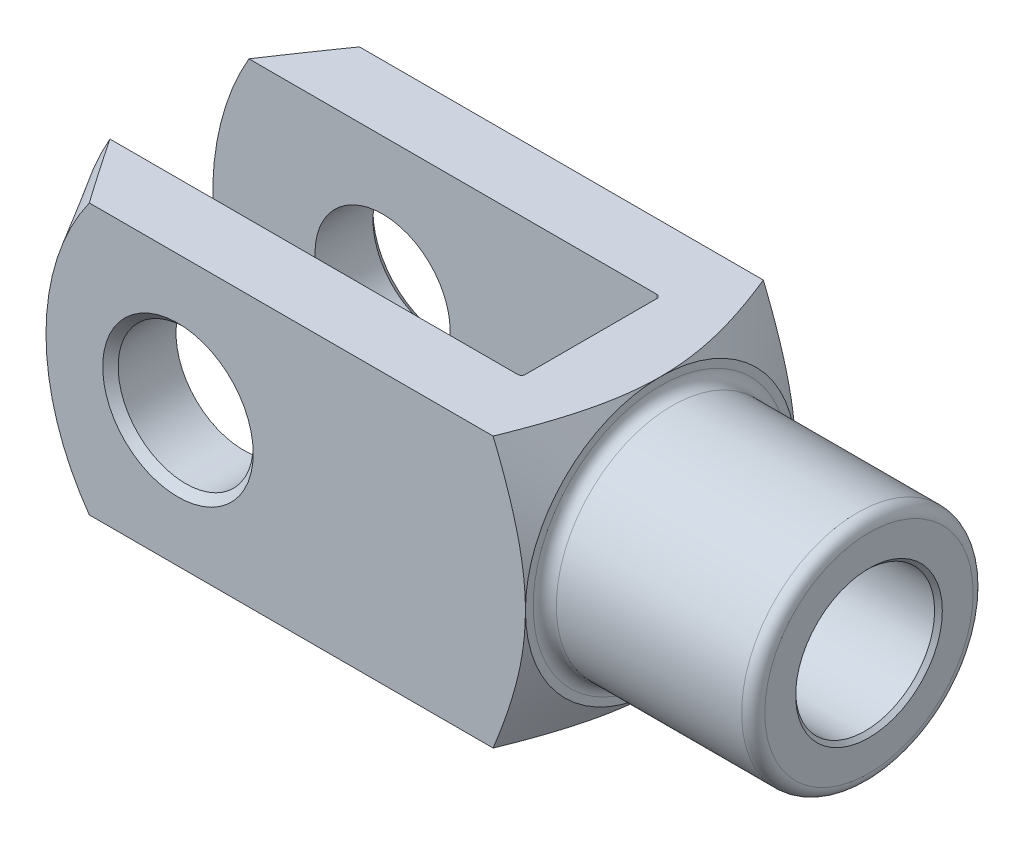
SolidWorks part; units mm, degrees
ref_plane "Front Plane" through (0, 0, 0) normal (0, 0, 1) x (1, 0, 0)
ref_plane "Top Plane" through (0, 0, 0) normal (0, 1, 0) x (1, 0, 0)
ref_plane "Right Plane" through (0, 0, 0) normal (1, 0, 0) x (0, 0, -1)
sketch "Sketch1" plane through (0, 0, 0) normal (1, 0, 0) x (0, 0, -1)
  line L0 (0, 0) -> (0, 50000) construction
  line L1 (0, 0) -> (50000, 0) construction
  line L2 (-35, -35) -> (-35, 35)
  line L3 (-35, 35) -> (35, 35)
  line L4 (35, -35) -> (35, 35)
  line L5 (-35, -35) -> (35, -35)
  point P9 (0, 35)
  point P11 (35, 0)
  point P12 (-35, 0)
  dimension "D1" = 70
  dimension "D2" = 70
extrude "Extrude1" add sketch "Sketch1" against normal blind 188
sketch "Sketch2" plane through (0, 0, 0) normal (1, 0, 0) x (0, 0, -1)
  circle A0 centre (0, 0) radius 30
  circle A1 centre (0, 0) radius 60
  dimension "D1" = 60
  dimension "D2" = 120
extrude "Extrude2" cut sketch "Sketch2" against normal blind 54
sketch "Sketch3" plane through (0, 0, 35) normal (0, 0, 1) x (1, 0, 0)
  circle A0 centre (-144, 0) radius 17.5
  dimension "D1" = 35
  dimension "D2" = 144
extrude "Extrude3" cut sketch "Sketch3" against normal through all
sketch "Sketch4" plane through (0, 35, 0) normal (0, 1, 0) x (1, 0, 0)
  line L0 (0, 0) -> (-50000, 0) construction
  line L1 (-188, -18) -> (-188, 18)
  line L2 (-188, 35) -> (-188, -35) construction
  line L3 (-188, 18) -> (-72, 18)
  line L4 (-72, 18) -> (-72, -18)
  line L5 (-144, 35) -> (-144, -35) construction
  line L6 (-188, -18) -> (-72, -18)
  point P7 (-144, 0)
  point P13 (-72, 0)
  point P14 (-188, 0)
  dimension "D1" = 72
  dimension "D2" = 36
extrude "Extrude4" cut sketch "Sketch4" against normal through all
fillet "Fillet1" radius 1 2 edges at (-72, 0, 18) (-72, 0, -18)
fillet "Fillet2" radius 3 2 edges at (0, 0, -30) (-54, 0, -30)
chamfer "Chamfer2" distance 2 angle 45 2 edges at (-126.5, 0, -35) (-126.5, 0, 35)
sketch "Sketch6" plane through (0, 0, 0) normal (0, 0, 1) x (1, 0, 0)
  line L0 (-54, -35) -> (-54, -70)
  line L1 (-54, -70) -> (-74.2073, -70)
  line L2 (-74.2073, -70) -> (-54, -35)
  dimension "D1" = 30
  dimension "D2" = 70
revolve "Cut-Revolve1" cut sketch "Sketch6" angle 360 about axis through (-54, 0, 0) along (1, 0, 0)
sketch "Sketch7" plane through (0, 0, 0) normal (0, 1, 0) x (1, 0, 0)
  line L0 (-178.185, -35) -> (-188, -18)
  line L1 (-188, 18) -> (-178.185, 35)
  line L2 (-178.185, 35) -> (-258, 35)
  line L3 (-188, 18) -> (-188, -18)
  line L4 (-258, 35) -> (-258, -35)
  line L5 (-258, -35) -> (-178.185, -35)
  line L6 (-188, 35) -> (-62.3701, 35) construction
  line L7 (-188, -35) -> (-62.3701, -35) construction
  line L8 (-118, 0.6162) -> (-118, 50000.6162) construction
  dimension "D1" = 120
  dimension "D2" = 70
  dimension "D3" = 70
revolve "Cut-Revolve2" cut sketch "Sketch7" angle 180 about L8
sketch "Sketch8" plane through (0, 0, 0) normal (1, 0, 0) x (0, 0, -1)
  circle A0 centre (0, 0) radius 18
  dimension "D1" = 36
extrude "Extrude5" cut sketch "Sketch8" against normal through all
chamfer "Chamfer3" distance 1 angle 45 1 edges at (0, 0, -18)
equation "\"D2@Sketch1\" = \"D1@Sketch1\""
equation "\"D2@Sketch2\" = \"D1@Sketch2\"*2"
equation "\"D2@Sketch6\" = \"D1@Sketch1\""
equation "\"D2@Sketch7\" = \"D1@Sketch1\""
equation "\"D3@Sketch7\" = \"D1@Sketch1\""
